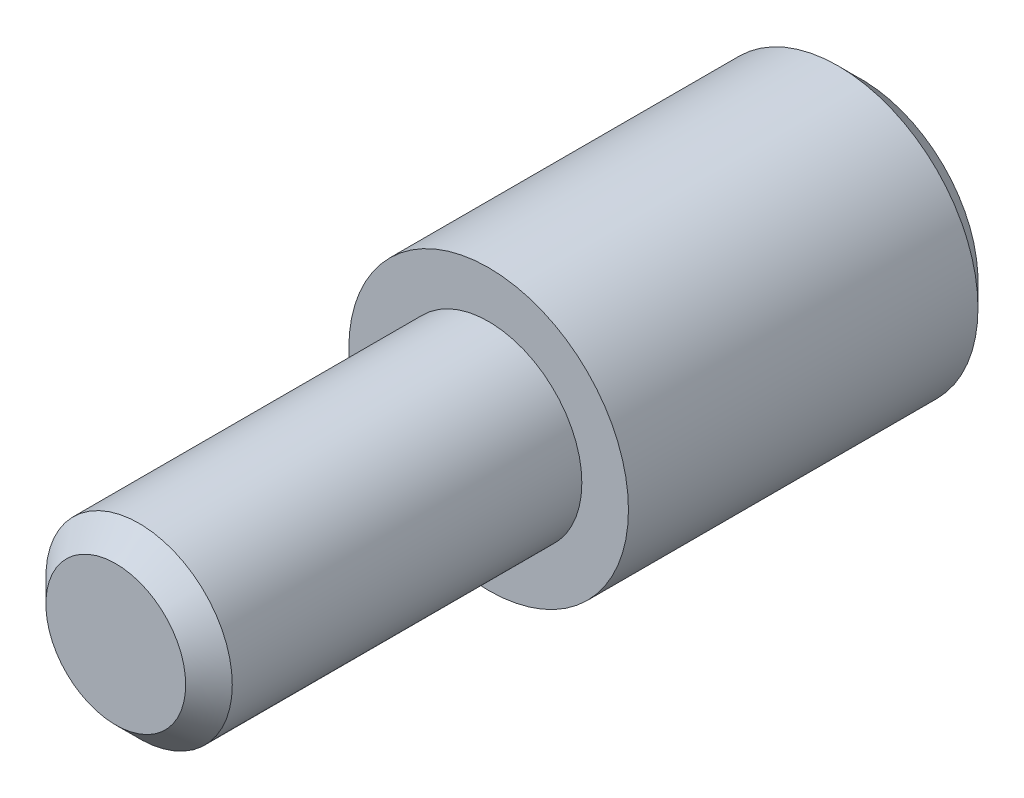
SolidWorks part; units mm, degrees
ref_plane "Plan1" through (0, 0, 0) normal (0, 0, 1) x (1, 0, 0)
ref_plane "Plan2" through (0, 0, 0) normal (0, 1, 0) x (1, 0, 0)
ref_plane "Plan3" through (0, 0, 0) normal (1, 0, 0) x (0, 0, -1)
sketch "Esquisse1" plane through (0, 0, 0) normal (0, 1, 0) x (1, 0, 0)
  line L0 (0, 0) -> (0, 30) construction
  line L1 (0, 0) -> (2, 0)
  line L2 (2, 0) -> (2, 8)
  line L3 (2, 8) -> (3, 8)
  line L4 (3, 8) -> (3, 16)
  line L5 (3, 16) -> (0, 16)
  line L6 (0, 16) -> (0, 0)
  dimension "D1" = 2
  dimension "D2" = 3
  dimension "D3" = 8
  dimension "D4" = 16
revolve "Base-Révolution" add sketch "Esquisse1" angle 360 about L0
chamfer "Chanfrein1" distance 0.5 angle 45
